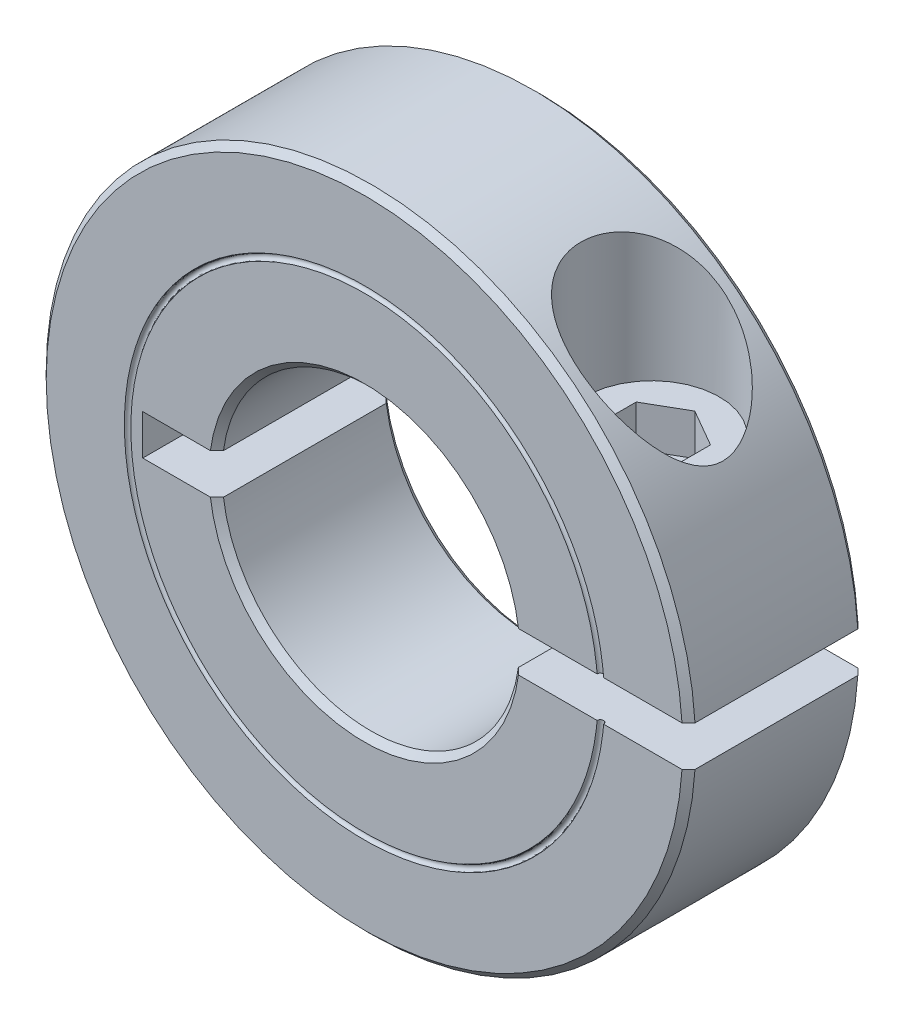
SolidWorks part; units mm, degrees
other "LUMP1"
ref_plane "Front" through (0, 0, 0) normal (0, 0, 1) x (1, 0, 0)
ref_plane "Top" through (0, 0, 0) normal (0, 1, 0) x (1, 0, 0)
ref_plane "Right" through (0, 0, 0) normal (1, 0, 0) x (0, 0, -1)
imported_body "Imported1"
move or copy body "Body-Move/Copy1" bodies to move or copy 101 placed by mates yes
ref_plane "Z Location" through (0, 0, 37.4523) normal (0, 0, 1) x (1, 0, 0)
sketch "Y Location" plane through (0, 0, 37.4523) normal (0, 0, 1) x (1, 0, 0)
  line L0 (0, 0) -> (0, 97.5081) construction
  dimension "BD71" = 97.5081
move or copy body "Body-Move/Copy2" bodies to move or copy 101 placed by mates yes
other "Distance1" parameters "D1"=5.1562
